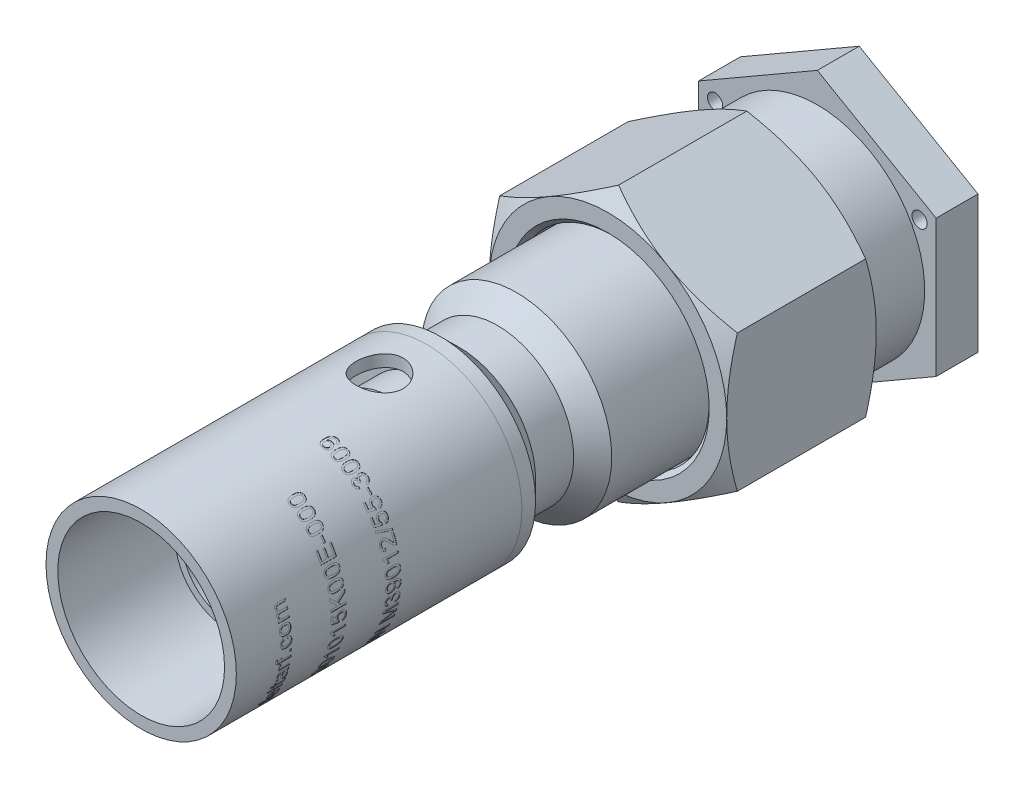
SolidWorks part; units mm, degrees
ref_plane "Front Plane" through (0, 0, 0) normal (0, 0, 1) x (1, 0, 0)
ref_plane "Top Plane" through (0, 0, 0) normal (0, 1, 0) x (1, 0, 0)
ref_plane "Right Plane" through (0, 0, 0) normal (1, 0, 0) x (0, 0, -1)
imported_body "12-674-1-solid1"
imported_body "44-811-1-solid1"
imported_body "29-3-1-solid1"
imported_body "53-0-1-solid1"
imported_body "25-157-1-solid1"
imported_body "33-390-1-solid1"
imported_body "61-5-1-solid1"
sketch "Sketch1" plane through (0, 0, -17.9324) normal (0, 0, -1) x (-1, 0, 0)
  circle A0 centre (0, 0) radius 2.0987
extrude "Boss-Extrude1" add sketch "Sketch1" against normal up to surface (8.4074 mm away)
sketch "Sketch2" plane through (0, 0, -15.621) normal (0, 0, -1) x (-1, 0, 0)
  circle A0 centre (0, 0) radius 3.7826
extrude "Boss-Extrude2" add sketch "Sketch2" against normal up to surface (2.159 mm away)
sketch "Sketch3" plane through (0, 0, 0) normal (1, 0, 0) x (0, 0, -1)
  line L0 (-1.0749, -4.0212) -> (-1.0749, 6.9866) construction
  text T0 "www.deltarf.com  P/N 1301015K00E-000  MIL P/N M39012/55-3009" height in points 2
  point P3 (-1.5494, -5.5395)
  point P4 (-1.0749, -4.0212)
wrap "Wrap1" sketch "Sketch3" wrap type deboss source sketch "Sketch3" thickness 0.0102 parameters "D1"=0.0102
